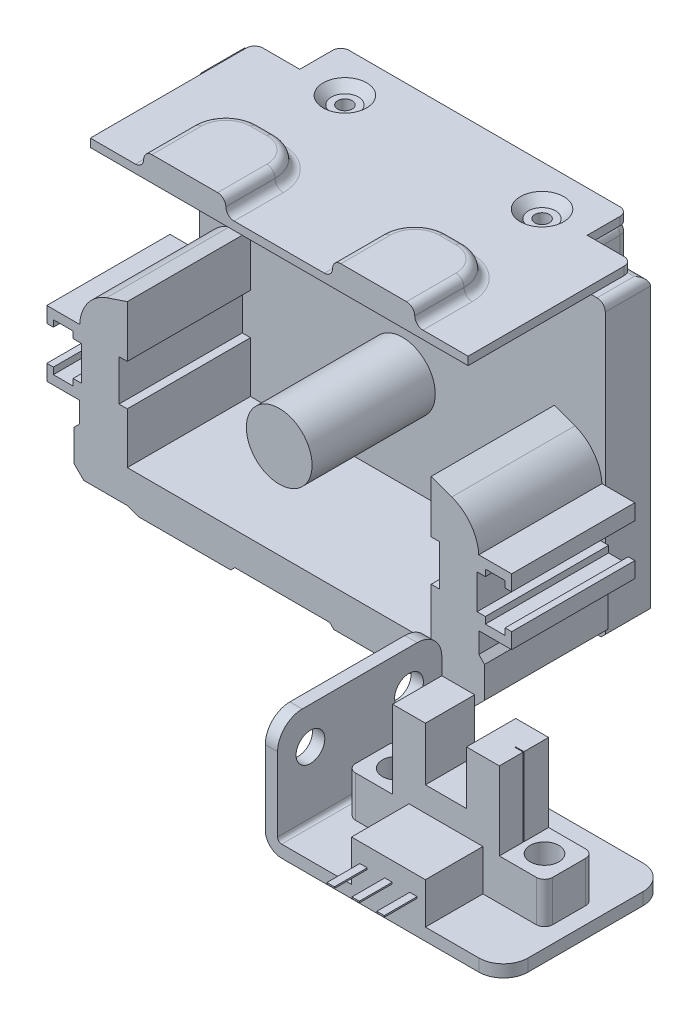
SolidWorks part; units mm, degrees
ref_plane "前视基准面" through (0, 0, 0) normal (0, 0, 1) x (1, 0, 0)
ref_plane "上视基准面" through (0, 0, 0) normal (0, 1, 0) x (1, 0, 0)
ref_plane "右视基准面" through (0, 0, 0) normal (1, 0, 0) x (0, 0, -1)
imported_body "输入1"
sketch "草图1" plane through (0, 30.7089, 0) normal (0, 1, 0) x (1, 0, 0)
  line L1 (-65.7432, -147.1712) -> (64.6143, -147.1712)
  line L2 (-65.7432, -147.1712) -> (-65.7432, 50)
  line L3 (64.6143, 50) -> (1.7638, 50)
  line L4 (64.6143, -147.1712) -> (64.6143, 50)
  line L5 (1.7638, 5) -> (1.7638, 55) construction
  line L6 (1.7638, 50) -> (1.7638, 85)
  line L7 (1.7638, 75) -> (1.7638, 100) construction
  line L8 (1.7638, 85) -> (-54.8362, 85)
  line L9 (-54.8362, 100) -> (-54.8362, -50) construction
  line L10 (-54.8362, 85) -> (-54.8362, 50)
  line L11 (-54.8362, 50) -> (-65.7432, 50)
  line L12 (-10.0362, 110) -> (-43.0362, 110) construction
  dimension "D1" = 35
  dimension "D2" = 60
extrude "切除-拉伸1" cut sketch "草图1" against normal up to surface (39 mm away)
